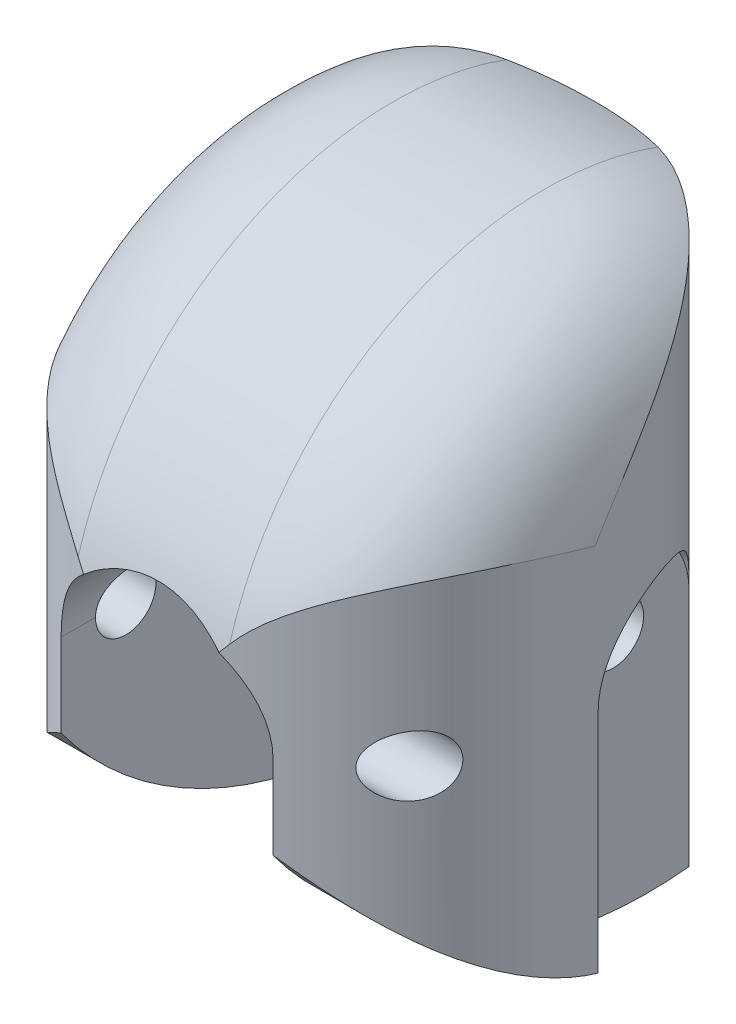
SolidWorks part; units mm, degrees
ref_plane "Ebene vorne" through (0, 0, 0) normal (0, 0, 1) x (1, 0, 0)
ref_plane "Ebene oben" through (0, 0, 0) normal (0, 1, 0) x (1, 0, 0)
ref_plane "Ebene rechts" through (0, 0, 0) normal (1, 0, 0) x (0, 0, -1)
sketch "Skizze1" plane through (0, 0, 0) normal (0, 0, 1) x (1, 0, 0)
  line L0 (0, -7) -> (0, 7.5)
  line L1 (-7.5, 0) -> (-7.5, -8)
  line L2 (-7.5, -8) -> (0, -8)
  line L3 (0, -8) -> (0, -7)
  arc A0 (0, 7.5) -> (-7.5, 0) centre (0, 0) ccw
  arc A4 (0, 7.5) -> (-7.5, 0) centre (0, 0) ccw
  dimension "D1" = 15
  dimension "D3" = 8
  dimension "D2" = 1
sketch "Skizze3" plane through (0, 0, 0) normal (0, 0, 1) x (1, 0, 0)
  line L0 (0, 0) -> (0, 25.4) construction
revolve "Rotation6" add sketch "Skizze1" angle 360 about L0
sketch "Skizze28" plane through (0, 0, 0) normal (1, 0, 0) x (0, 0, -1)
  line L0 (-7.5, 0) -> (7.5, 0)
  line L1 (7.5, 0) -> (-7.5, 0) construction
  line L2 (7.5, 0) -> (7.5, 10)
  line L3 (-7.5, 0) -> (-7.5, -8) construction
  arc A0 (7.5, 0) -> (-7.5, 0) centre (0, 0) ccw construction
  arc A1 (7.5, 10) -> (-7.5, 0) centre (3.3333, 0) ccw
  dimension "D1" = 10
extrude "Aufsatz-Linear austragen3" add sketch "Skizze28" along normal mid plane 15
hole_wizard "Durchgangsloch für M32" positions "3D-Skizze2" profile "Skizze30" hole size "M3" standard "DIN"
sketch3d "3D-Skizze2"
  point P0 (0, 0, 7.5)
sketch "Skizze30" plane through (0, 0, 7.5) normal (1, 0, 0) x (0, -1, 0)
  line L0 (0, 0) -> (0, 15)
  line L1 (0, 15) -> (1.7, 15)
  line L2 (1.7, 15) -> (1.7, 0)
  line L5 (1.7, 0) -> (0, 0)
  line L11 (0, -6.35) -> (0, 107.95) construction
  dimension "Bohrerdurchmesser" = 3.4
  dimension "Bohrungstiefe" = 15
ref_plane "Ebene1" through (0, 0, -7.5) normal (0, 0, -1) x (-1, 0, 0)
sketch "Skizze12" plane through (0, 0, -7.5) normal (0, 0, -1) x (-1, 0, 0)
  line L1 (3.2332, 0) -> (1.6166, 2.8)
  line L2 (1.6166, 2.8) -> (-1.6166, 2.8)
  line L3 (-1.6166, 2.8) -> (-3.2332, 0)
  line L4 (-3.2332, 0) -> (-1.6166, -2.8)
  line L5 (-1.6166, -2.8) -> (1.6166, -2.8)
  line L6 (1.6166, -2.8) -> (3.2332, 0)
  circle A0 centre (0, 0) radius 2.8 construction
  dimension "D1" = 5.6
extrude "Schnitt-Linear austragen4" cut sketch "Skizze12" against normal blind 2.6
sketch "Skizze13" plane through (0, 0, 0) normal (0, 1, 0) x (1, 0, 0)
  line L1 (7.5, -7.5) -> (1.7, -7.5) construction
  circle A0 centre (0, -4.1332) radius 1.5
  dimension "D1" = 3
  dimension "D2" = 3.3668
sketch "Skizze10" plane through (0, 0, 0) normal (0, 0, 1) x (1, 0, 0)
  line L0 (-3.5, 0) -> (-3.5, -11.1995)
  line L1 (-3.5, -11.1995) -> (3.5, -11.1995)
  line L2 (3.5, -11.1995) -> (3.5, 0)
  arc A1 (3.5, 0) -> (-3.5, 0) centre (0, 0) ccw
  arc A2 (1.7, 0) -> (-1.7, 0) centre (0, 0) ccw construction
  dimension "D1" = 3.5
  dimension "D2" = 7
extrude "Schnitt-Linear austragen3" cut sketch "Skizze10" along normal blind 19.5 and the other way blind 4 from offset 3
ref_plane "Ebene2" [suppressed] through (0, 0, 2.6332) normal (0, 0, 1) x (1, 0, 0)
sketch "Skizze16" [suppressed] plane through (0, 0, 2.6332) normal (0, 0, 1) x (1, 0, 0)
  line L0 (0, -200000) -> (0, 200025.4) construction
  circle A0 centre (0, 4.2759) radius 0.3
  dimension "D1" = 0.6
  dimension "D2" = 1.8
ref_plane "Schnittebene" through (0, 0, -2) normal (0, 0, 1) x (1, 0, 0)
sketch "Skizze19" plane through (0, 0, -1) normal (0, 0, 1) x (1, 0, 0)
  line L0 (0, 3.5) -> (0, -8)
  line L1 (0, -200000) -> (0, 200025.4) construction
  line L2 (0, -8) -> (-3.5, -8)
  line L4 (3.5, -8) -> (3.5, 0)
  line L7 (-3.5, 0) -> (-3.5, -8)
  line L11 (-3.5, 0) -> (-3.5, -8)
  line L13 (-3.5, -8) -> (3.5, -8)
  line L15 (-3.5, -8) -> (0, -8)
  arc A0 (-3.5, 0) -> (0, 3.5) centre (0, 0) cw
  arc A2 (3.5, 0) -> (-3.5, 0) centre (0, 0) ccw construction
  arc A5 (3.5, 0) -> (-3.5, 0) centre (0, 0) ccw
  dimension "D1" = 0
revolve "Schnitt-Rotation2" [suppressed] cut sketch "Skizze19" angle 360 about L0
sketch "Skizze20" plane through (0, 0, 0) normal (1, 0, 0) x (0, 0, -1)
  line L0 (7.5, -8) -> (7.5, -2.8) construction
  line L3 (-6.6332, -2.7418) -> (-6.6332, -10.5026)
  line L4 (-6.6332, -10.5026) -> (7.5, -10.5026)
  line L5 (7.5, -10.5026) -> (7.5, -7.4418)
  line L6 (-6.6332, 0) -> (-6.6332, -8) construction
  line L7 (7.5, -8) -> (7.5, -2.8) construction
  line L8 (-6.6332, -8) -> (7.5, -8) construction
  arc A0 (-6.6332, -2.7418) -> (7.5, -7.4418) centre (3.7495, 4.8799) ccw
  dimension "D1" = 12.8799
  dimension "D2" = 4.7
extrude "Schnitt-Linear austragen6" cut sketch "Skizze20" against normal through all both and the other way through all
ref_plane "Ebene4" through (0, 0, 4.11) normal (0, 0, 1) x (1, 0, 0)
fillet "Verrundung1" radius 5 4 edges at (-7.5, 5, -7.5) (7.5, 5, -7.5) (7.5, 9.0139, 2.6759) (-7.5, 9.0139, 2.6759)
sketch "Skizze31" plane through (0, 0, 0) normal (0, 1, 0) x (1, 0, 0)
  circle A0 centre (0, 0) radius 7.5
  circle A1 centre (0, 0) radius 8.5355
  arc A2 (3.5, -7.399) -> (7.5, -2.5) centre (2.5, -2.5) ccw construction
  arc A3 (3.5, -6.6332) -> (7.5, 0) centre (0, 0) ccw construction
extrude "Schnitt-Linear austragen7" cut sketch "Skizze31" along normal blind 15
sketch "Skizze32" plane through (0, 0, 0) normal (1, 0, 0) x (0, 0, -1)
  line L0 (-2.6332, 0) -> (-5.6332, 0) construction
  circle A0 centre (-4.5, 0) radius 1
  dimension "D1" = 4.5
  dimension "D2" = 2
extrude "Schnitt-Linear austragen8" cut sketch "Skizze32" against normal mid plane 15
other "Schneiden1" [suppressed]
ref_plane "Düzlem1" through (7.5, 0, 0) normal (1, 0, 0) x (0, 0, -1)
sketch "Çizim1" plane through (7.5, 0, 0) normal (1, 0, 0) x (0, 0, -1)
  line L0 (1, 0) -> (1, -7.7031) construction
  line L3 (-5.5, 0) -> (-6.6332, 0) construction
  line L4 (0.1, 0) -> (0.1, -8.5)
  line L5 (5.1, 0) -> (5.1, -8.5)
  line L6 (5.1, -8.5) -> (0.1, -8.5)
  line L7 (-2.6332, 0) -> (-5.6332, 0) construction
  arc A2 (5.1, 0) -> (0.1, 0) centre (2.6, 0) ccw
  point P1 (0, 0)
  point P5 (0, 0)
  dimension "D1" = 8.5
  dimension "D2" = 5
  dimension "D3" = 0.9
extrude "Kes-Ekstrüzyon1" cut sketch "Çizim1" against normal blind 2
sketch "Çizim6" plane through (5.5, 0, 0) normal (1, 0, 0) x (0, 0, -1)
  circle A0 centre (2.6, 0) radius 1
  arc A1 (5.099, 0.07) -> (0.1, 0) centre (2.6, 0) ccw construction
  dimension "D1" = 2
extrude "Kes-Ekstrüzyon11" cut sketch "Çizim6" against normal blind 3
mirror "Aynalama1" about plane through (0, 0, 0) normal (1, 0, 0) of "Kes-Ekstrüzyon1"
mirror "Aynalama3" about plane through (0, 0, 0) normal (1, 0, 0) of "Kes-Ekstrüzyon11", "Kes-Ekstrüzyon1"
